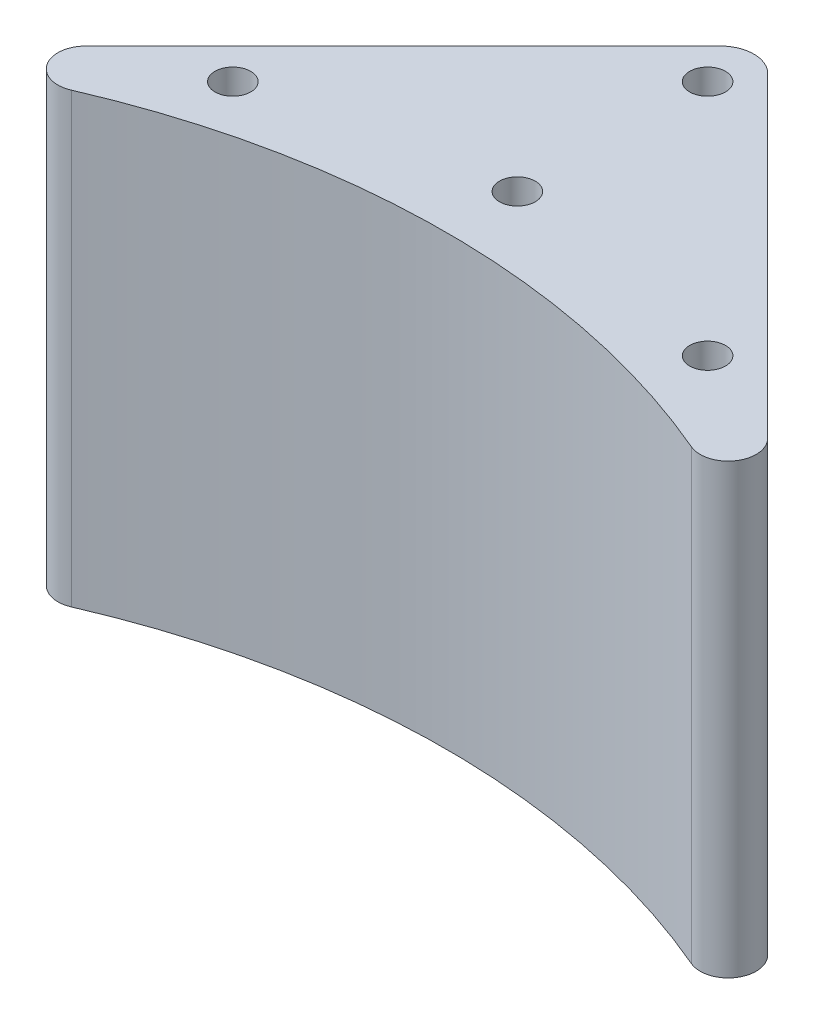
SolidWorks part; units mm, degrees
ref_plane "前视基准面" through (0, 0, 0) normal (0, 0, 1) x (1, 0, 0)
ref_plane "上视基准面" through (0, 0, 0) normal (0, 1, 0) x (1, 0, 0)
ref_plane "右视基准面" through (0, 0, 0) normal (1, 0, 0) x (0, 0, -1)
other "Configuration Table"
sketch "草图1" plane through (0, 0, 0) normal (0, 1, 0) x (1, 0, 0)
  line L0 (-215.6676, 208.5965) -> (-208.5965, 215.6676) construction
  line L1 (-215.6676, 208.5965) -> (208.5965, -215.6676) construction
  line L2 (-208.5965, 215.6676) -> (215.6676, -208.5965) construction
  line L3 (208.5965, -215.6676) -> (215.6676, -208.5965) construction
  line L4 (-215.6676, 208.5965) -> (215.6676, -208.5965) construction
  line L5 (-208.5965, 215.6676) -> (208.5965, -215.6676) construction
  line L6 (-208.5965, -215.6676) -> (-215.6676, -208.5965) construction
  line L7 (-208.5965, -215.6676) -> (215.6676, 208.5965) construction
  line L8 (-215.6676, -208.5965) -> (208.5965, 215.6676) construction
  line L9 (215.6676, 208.5965) -> (208.5965, 215.6676) construction
  line L10 (-208.5965, -215.6676) -> (208.5965, 215.6676) construction
  line L11 (-215.6676, -208.5965) -> (215.6676, 208.5965) construction
  line L12 (0, 0) -> (0, 123.476) construction
  line L13 (0, 0) -> (28.2843, -28.2843) construction
  line L14 (0, 0) -> (28.2843, -28.2843) construction
  line L15 (0, 0) -> (-28.2843, -28.2843) construction
  line L16 (-49.4975, -56.5685) -> (-56.5685, -63.6396) construction
  line L17 (-56.5685, -63.6396) -> (-63.6396, -56.5685) construction
  line L18 (-63.6396, -56.5685) -> (-56.5685, -49.4975) construction
  line L19 (-63.6396, 56.5685) -> (-56.5685, 63.6396) construction
  line L20 (-56.5685, 63.6396) -> (-49.4975, 56.5685) construction
  line L21 (-56.5685, 49.4975) -> (-63.6396, 56.5685) construction
  line L22 (56.5685, 63.6396) -> (63.6396, 56.5685) construction
  line L23 (63.6396, 56.5685) -> (56.5685, 49.4975) construction
  line L24 (49.4975, 56.5685) -> (56.5685, 63.6396) construction
  line L25 (63.6396, -56.5685) -> (56.5685, -63.6396) construction
  line L26 (56.5685, -63.6396) -> (49.4975, -56.5685) construction
  line L27 (56.5685, -49.4975) -> (63.6396, -56.5685) construction
  line L28 (0, 0) -> (-56.5685, -49.4975) construction
  line L29 (-30.5391, -37.7516) -> (-0.0707, -7.2832)
  line L30 (-0.0707, -7.2832) -> (30.2909, -37.6448)
  circle A0 centre (0, 0) radius 2.1 construction
  circle A1 centre (28.2843, -28.2843) radius 2.1 construction
  circle A2 centre (56.5685, -56.5685) radius 2.1 construction
  circle A3 centre (-28.2843, -28.2843) radius 2.1 construction
  circle A4 centre (-56.5685, -56.5685) radius 2.1 construction
  circle A5 centre (-28.2843, 28.2843) radius 2.1 construction
  circle A6 centre (-56.5685, 56.5685) radius 2.1 construction
  circle A7 centre (28.2843, 28.2843) radius 2.1 construction
  circle A8 centre (56.5685, 56.5685) radius 2.1 construction
  arc A9 (-49.4975, -56.5685) -> (49.4975, -56.5685) centre (0, -106.066) cw construction
  arc A10 (-56.5685, 49.4975) -> (-56.5685, -49.4975) centre (-106.066, 0) cw construction
  arc A11 (49.4975, 56.5685) -> (-49.4975, 56.5685) centre (0, 106.066) cw construction
  arc A12 (56.5685, -49.4975) -> (56.5685, 49.4975) centre (106.066, 0) cw construction
  circle A13 centre (-21.2132, -33.9411) radius 1.6
  circle A14 centre (21.2132, -33.9411) radius 1.6
  circle A15 centre (0, -12.7279) radius 1.6
  circle A16 centre (0, -29.7279) radius 1.6
  arc A26 (-27.7792, -41.814) -> (27.5396, -41.711) centre (0, -106.066) cw
  arc A27 (27.5396, -41.711) -> (30.2909, -37.6448) centre (28.5231, -39.4126) ccw
  arc A28 (-27.7792, -41.814) -> (-30.5391, -37.7516) centre (-28.7713, -39.5193) cw
  point P1 (0, 0)
  point P2 (0, 0)
  point P70 (0, 0)
  point P72 (0, 0)
  point P73 (0, 0)
  point P85 (0, 0)
  dimension "D8" = 4.2
  dimension "D12" = 70
  dimension "D15" = 3.2
  dimension "D22" = 2.5
  dimension "D23" = 2.5
  dimension "D1" = 45
  dimension "D2" = 10
  dimension "D3" = 10
  dimension "D4" = 600
  dimension "D5" = 600
  dimension "D7" = 40
  dimension "D10" = 90
  dimension "D11" = 40
  dimension "D13" = 5
  dimension "D16" = 4
  dimension "D17" = 4
  dimension "D18" = 4
  dimension "D19" = 30
  dimension "D20" = 30
  dimension "D21" = 17
  dimension "D24" = 0.2
  dimension "D25" = 0.2
  dimension "D6" = 3
  dimension "D9" = 4
  dimension "D14" = 4
extrude "凸台-拉伸1" add sketch "草图1" along normal blind 40
fillet "圆角1" radius 3 1 edges at (-0.0707, 20, 7.2832)
